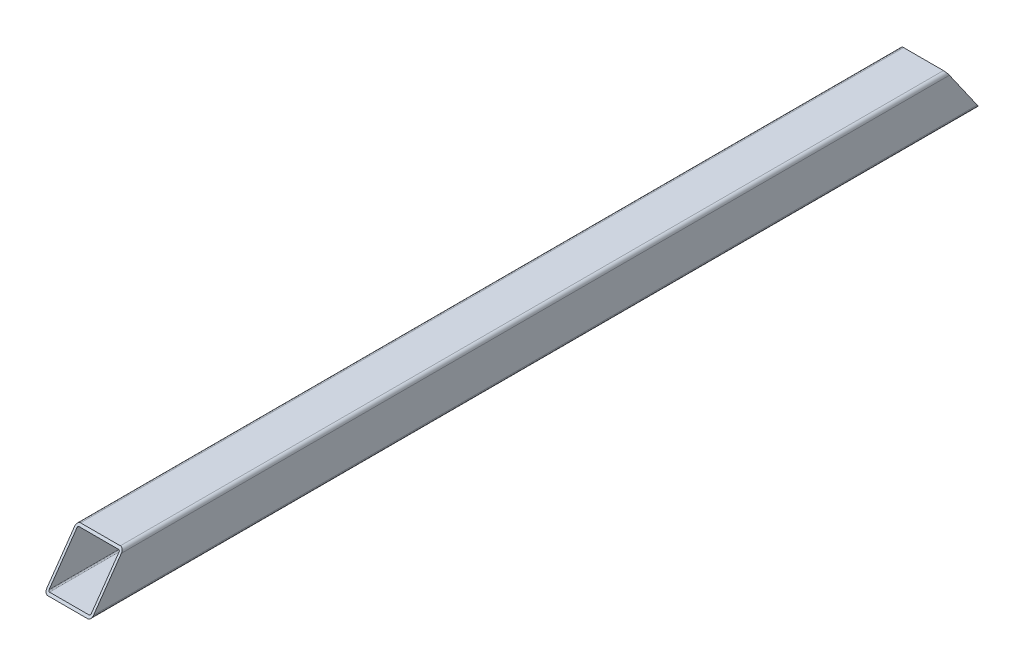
SolidWorks part; units mm, degrees
ref_plane "Face" through (0, 0, 0) normal (0, 0, 1) x (1, 0, 0)
ref_plane "Dessus" through (0, 0, 0) normal (0, 1, 0) x (1, 0, 0)
ref_plane "Droite" through (0, 0, 0) normal (1, 0, 0) x (0, 0, -1)
sketch "Esquisse1" plane through (0, 0, 0) normal (0, 0, 1) x (1, 0, 0)
  line L0 (2, -3) -> (2, -37)
  line L1 (3, 0) -> (37, 0)
  line L2 (0, -3) -> (0, -37)
  line L3 (3, -40) -> (37, -40)
  line L4 (40, -3) -> (40, -37)
  line L5 (3, -38) -> (37, -38)
  line L6 (38, -3) -> (38, -37)
  line L7 (3, -2) -> (37, -2)
  arc A0 (0, -3) -> (3, 0) centre (3, -3) cw
  arc A1 (0, -37) -> (3, -40) centre (3, -37) ccw
  arc A2 (37, 0) -> (40, -3) centre (37, -3) cw
  arc A3 (37, -40) -> (40, -37) centre (37, -37) ccw
  arc A4 (2, -37) -> (3, -38) centre (3, -37) ccw
  arc A5 (37, -38) -> (38, -37) centre (37, -37) ccw
  arc A6 (37, -2) -> (38, -3) centre (37, -3) cw
  arc A7 (2, -3) -> (3, -2) centre (3, -3) cw
  point P7 (0, 0)
  point P10 (0, -40)
  point P13 (40, 0)
  dimension "D3" = 3
  dimension "D1" = 40
  dimension "D2" = 40
  dimension "D4" = 2
extrude "Base-Extrusion" add sketch "Esquisse1" along normal blind 760
sketch "Esquisse2" plane through (0, 0, 0) normal (-1, 0, 0) x (0, 0, 1)
  line L0 (0, 0) -> (0, -40)
  line L1 (0, -40) -> (28.0083, 0)
  line L2 (28.0083, 0) -> (0, 0)
  line L3 (0, -3) -> (0, -37) construction
  line L4 (760, 0) -> (0, 0) construction
  line L5 (760, -40) -> (0, -40) construction
  dimension "D1" = 55
extrude "Enlèv. mat.-Extru.1" cut sketch "Esquisse2" against normal through all
sketch "Esquisse3" plane through (0, 0, 0) normal (-1, 0, 0) x (0, 0, 1)
  line L0 (731.9917, 0) -> (760, -40)
  line L1 (760, -40) -> (760, 0)
  line L2 (760, 0) -> (731.9917, 0)
  line L3 (760, -3) -> (760, -37) construction
  line L4 (760, 0) -> (28.0083, 0) construction
  line L5 (760, -40) -> (0, -40) construction
  dimension "D1" = 55
extrude "Enlèv. mat.-Extru.2" cut sketch "Esquisse3" against normal through all
